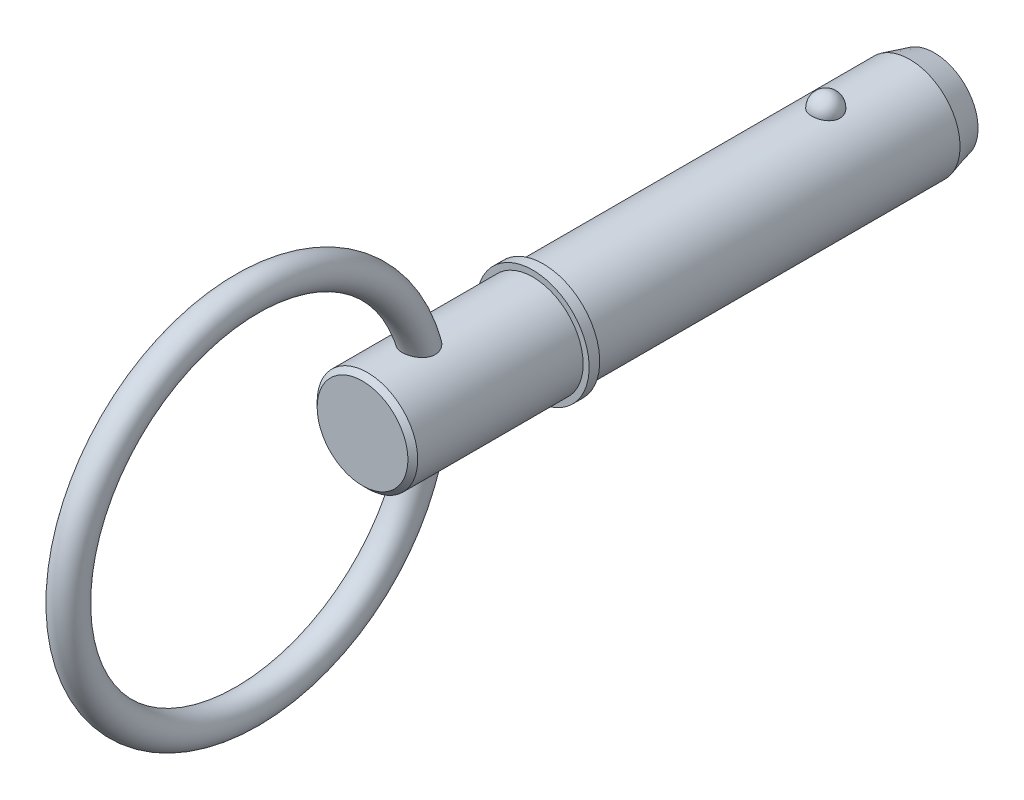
SolidWorks part; units mm, degrees
ref_plane "Front Plane" through (0, 0, 0) normal (0, 0, 1) x (1, 0, 0)
ref_plane "Top Plane" through (0, 0, 0) normal (0, 1, 0) x (1, 0, 0)
ref_plane "Right Plane" through (0, 0, 0) normal (1, 0, 0) x (0, 0, -1)
sketch "Sketch2" plane through (0, 0, 0) normal (0, 0, 1) x (1, 0, 0)
  circle A0 centre (0, 0) radius 7.145
  point P3 (0, 7.145)
  dimension "D1" = 14.29
extrude "Boss-Extrude1" add sketch "Sketch2" along normal blind 38.1
sketch "Sketch3" plane through (0, 0, 0) normal (0, 0, -1) x (-1, 0, 0)
  circle A0 centre (0, 0) radius 7.145
  dimension "D1" = 14.29
extrude "Boss-Extrude2" add sketch "Sketch3" along normal blind 17.45
chamfer "Chamfer1" distance 3.5 angle 15 1 edges at (-7.145, 0, -17.45)
sketch "Sketch18" plane through (0, 0, 0) normal (1, 0, 0) x (0, 0, -1)
  line L0 (13.95, 7.145) -> (-38.1, 7.145) construction
  line L1 (2.02, 9.165) -> (2.02, 5.125)
  line L2 (-38.1, -7.145) -> (13.95, -7.145) construction
  arc A0 (2.02, 9.165) -> (2.02, 5.125) centre (2.02, 7.145) ccw
  point P4 (0, 7.145)
  dimension "D1" = 16.31
revolve "Revolve1" add sketch "Sketch18" angle 360 about L1
sketch "Sketch19" plane through (0, 0, 0) normal (1, 0, 0) x (0, 0, -1)
  line L0 (-33.7288, 0) -> (-46.4542, 0) construction
sketch "Sketch20" plane through (0, 0, 0) normal (1, 0, 0) x (0, 0, -1)
  line L0 (-38.1, 0) -> (-38.1, 8)
  line L1 (-38.1, 7.145) -> (-38.1, -7.145) construction
  line L2 (-38.1, 8) -> (-39.6, 8)
  line L3 (-39.6, 8) -> (-39.6, 0)
  line L4 (-33.7288, 0) -> (-46.4542, 0) construction
  line L5 (-39.6, 0) -> (-38.1, 0)
  dimension "D1" = 8
  dimension "D2" = 1.5
revolve "Revolve2" add sketch "Sketch20" angle 360 about L0
sketch "Sketch21" plane through (0, 0, 38.1) normal (0, 0, -1) x (-1, 0, 0)
  circle A0 centre (0, 0) radius 7.145
  dimension "D1" = 14.29
extrude "Boss-Extrude3" add sketch "Sketch21" against normal blind 25.7
chamfer "Chamfer2" distance 0.7 angle 45 1 edges at (-7.145, 0, 63.8)
sketch "Sketch23" plane through (0, 0, 0) normal (1, 0, 0) x (0, 0, -1)
  line L0 (-63.8, 6.445) -> (-63.8, -6.445) construction
  circle A0 centre (-80.2, 0) radius 25.4
  point P2 (-54.8, 0)
  dimension "D1" = 50.8
  dimension "D2" = 9
sketch "Sketch24" plane through (0, 0, 0) normal (0, 1, 0) x (1, 0, 0)
  circle A0 centre (0, -54.8) radius 2.25
  dimension "D1" = 4.5
sweep "Sweep1" add profiles "Sketch24" path "Sketch23"
